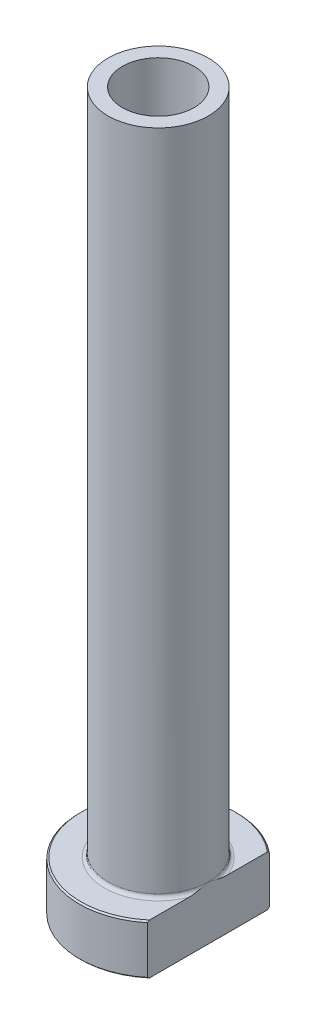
SolidWorks part; units mm, degrees
ref_plane "Front Plane" through (0, 0, 0) normal (0, 0, 1) x (1, 0, 0)
ref_plane "Top Plane" through (0, 0, 0) normal (0, 1, 0) x (1, 0, 0)
ref_plane "Right Plane" through (0, 0, 0) normal (1, 0, 0) x (0, 0, -1)
sketch "Sketch1" plane through (0, 0, 0) normal (0, 0, 1) x (1, 0, 0)
  line L0 (-5, 100) -> (-7, 100)
  line L1 (-7, 100) -> (-7, 7)
  line L2 (-7, 7) -> (-11, 7)
  line L3 (-11, 7) -> (-11, 0)
  line L4 (9.9, 0) -> (-9.9, 0) construction
  line L5 (-11, 0) -> (-5.25, 0)
  line L6 (-5, 55) -> (-5, 100)
  line L7 (0, 92.1877) -> (0, -15.5353) construction
  line L8 (0, -12.1) -> (0, 12.1) construction
  line L9 (-5, 55) -> (-5.25, 43)
  line L10 (-5.25, 43) -> (-5.25, 0)
  dimension "D1" = 0.25
  dimension "ID" = 10
  dimension "OD" = 14
  dimension "L" = 100
  dimension "H" = 22
  dimension "T" = 7
  dimension "N" = 45
  dimension "D2" = 12
  dimension "L-N" = 55
revolve "Revolve1" add sketch "Sketch1" angle 360 about L7
fillet "Fillet1" radius 0.5 1 edges at (0, 7, 7)
chamfer "Chamfer1" distance 0.2 angle 45 2 edges at (0, 7, 11) (0, 0, 11)
sketch "Sketch2" plane through (0, 0, 0) normal (0, -1, 0) x (1, 0, 0)
  line L0 (7, 8.4853) -> (7, -8.4853)
  circle A0 centre (0, 0) radius 11 construction
  arc A1 (7, 8.4853) -> (7, -8.4853) centre (0, 0) cw
  circle A2 centre (0, 0) radius 7 construction
extrude "Cut-Extrude1" cut sketch "Sketch2" against normal through all
chamfer "Chamfer2" distance 0.5 angle 45 1 edges at (0, 0, 5.25)
